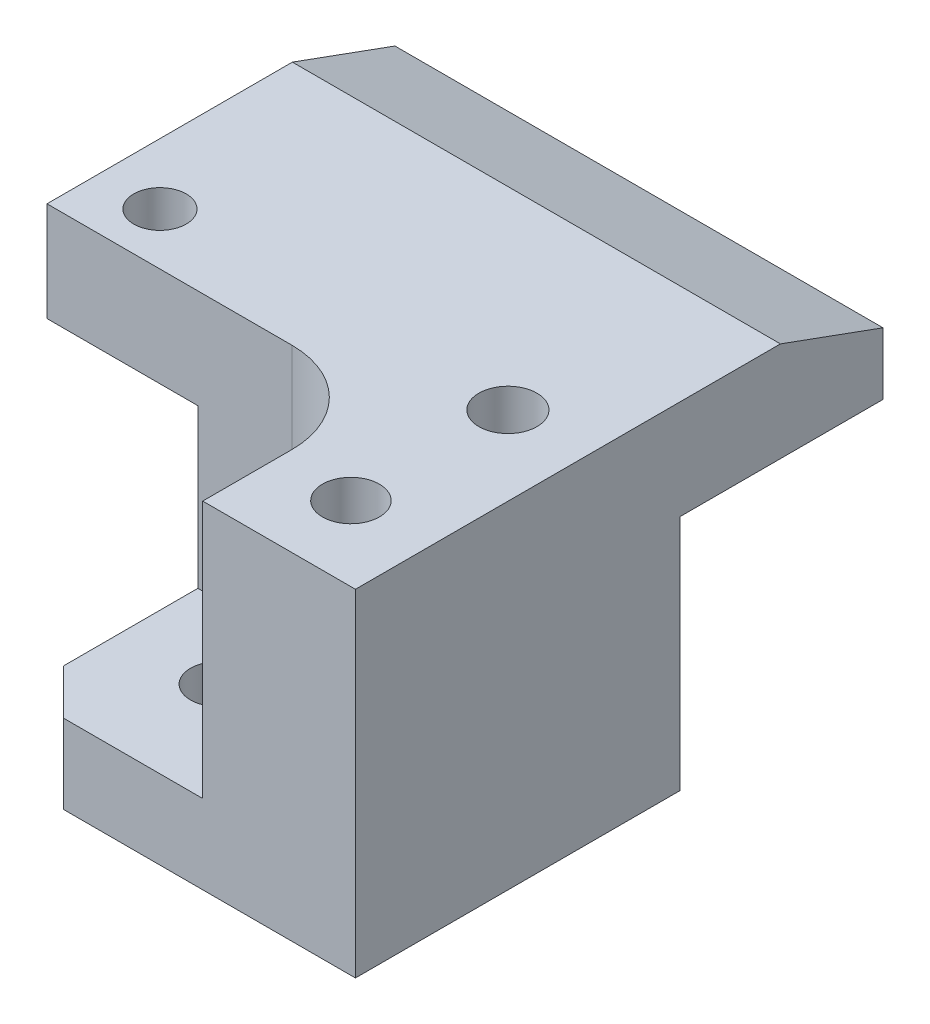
SolidWorks part; units mm, degrees
ref_plane "Front" through (0, 0, 0) normal (0, 0, 1) x (1, 0, 0)
ref_plane "Top" through (0, 0, 0) normal (0, 1, 0) x (1, 0, 0)
ref_plane "CENTER" through (0, 0, 0) normal (1, 0, 0) x (0, 0, -1)
sketch "Sketch1" plane through (0, 0, 0) normal (1, 0, 0) x (0, 0, -1)
  line L0 (-19.558, 0) -> (0, 0)
  line L1 (0, 0) -> (0, 14.478)
  line L2 (0, 14.478) -> (-19.558, 14.478)
  line L3 (-19.558, 14.478) -> (-19.558, 31.3453) construction
  line L7 (-19.558, 14.478) -> (-19.558, 0)
  dimension "D1" = 14.478
extrude "Extrude1" add sketch "Sketch1" along normal blind 13.716 and the other way blind 13.716
sketch "Sketch16" plane through (13.716, 0, 0) normal (1, 0, 0) x (0, 0, -1)
  line L0 (-7.8405, 14.478) -> (-7.8405, 30.48) construction
  line L1 (0, 0) -> (-7.8405, 0)
  line L2 (0, 0) -> (0, 8.89)
  line L3 (0, 8.89) -> (-7.8405, 8.89)
  line L4 (-7.8405, 0) -> (-7.8405, 8.89)
  line L5 (0, 14.478) -> (-19.558, 14.478) construction
  dimension "D1" = 5.588
extrude "Cut-Extrude1" cut sketch "Sketch16" against normal through all
sketch "Sketch15" plane through (0, 0, 0) normal (0, -1, 0) x (1, 0, 0)
  line L1 (5.2356, 7.8405) -> (-5.2356, 7.8405)
  line L2 (5.2356, 7.8405) -> (5.2356, 27.6467)
  line L3 (5.2356, 27.6467) -> (-5.2356, 27.6467)
  line L4 (-5.2356, 7.8405) -> (-5.2356, 27.6467)
  line L5 (-13.716, 7.8405) -> (13.716, 7.8405) construction
  point P6 (0, 7.8405)
extrude "Extrude2" add sketch "Sketch15" along normal blind 4.445
sketch "Sketch19" plane through (0, 0, 19.558) normal (0, 0, 1) x (1, 0, 0)
  line L1 (13.716, 14.478) -> (5.1308, 14.478)
  line L2 (13.716, 14.478) -> (13.716, 8.89)
  line L3 (13.716, 8.89) -> (5.1308, 8.89)
  line L4 (5.1308, 14.478) -> (5.1308, 8.89)
  line L5 (-13.716, 8.89) -> (13.716, 8.89) construction
  line L6 (5.1308, 14.478) -> (5.1308, 31.3453) construction
extrude "Extrude3" add sketch "Sketch19" along normal up to surface (10.095 mm away)
sketch "Sketch20" plane through (0, 8.89, 0) normal (0, -1, 0) x (1, 0, 0)
  line L1 (5.1308, 29.653) -> (13.716, 29.653)
  line L2 (5.1308, 29.653) -> (5.1308, 7.8405)
  line L3 (5.1308, 7.8405) -> (13.716, 7.8405)
  line L4 (13.716, 29.653) -> (13.716, 7.8405)
extrude "Extrude4" add sketch "Sketch20" along normal up to surface (13.335 mm away)
hole_wizard "M3.1 (3.1) Diameter Hole1" positions "Sketch14" profile "Sketch13" hole size "M3.1" standard "Ansi Metric"
sketch "Sketch14" plane through (-3.8106, 0, 4.1629) normal (0, -1, 0) x (1, 0, 0)
  line L0 (2.5164, 19.4901) -> (6.3664, 19.4901) construction
  line L1 (3.8064, 30.291) -> (3.8064, 8.6891) construction
  point P0 (3.8064, 19.4901)
sketch "Sketch13" plane through (-0.0042, 0, 23.653) normal (1, 0, 0) x (0, 0, 1)
  line L0 (0, 0) -> (0, 4.445)
  line L1 (0, 4.445) -> (1.55, 4.445)
  line L2 (1.55, 4.445) -> (1.55, 0)
  line L5 (1.55, 0) -> (0, 0)
  line L11 (0, -6.35) -> (0, 107.95) construction
  dimension "Thru Hole Dia." = 3.1
  dimension "Thru Hole Depth" = 4.445
sketch "Sketch21" plane through (0, 0, 0) normal (0, -1, 0) x (1, 0, 0)
  line L1 (-5.2356, 7.8405) -> (-13.716, 7.8405)
  line L2 (-5.2356, 7.8405) -> (-5.2356, 19.558)
  line L3 (-5.2356, 19.558) -> (-13.716, 19.558)
  line L4 (-13.716, 7.8405) -> (-13.716, 19.558)
extrude "Cut-Extrude2" cut sketch "Sketch21" against normal up to surface (8.89 mm away)
hole_wizard "#32 (0.116) Diameter Hole1" positions "Sketch18" profile "Sketch17" hole size "#32" standard "Ansi Inch"
sketch "Sketch18" plane through (0.0132, 8.89, -8.626) normal (0, -1, 0) x (1, 0, 0)
  line L4 (-13.7292, 8.626) -> (-13.7292, 28.184) construction
  line L5 (-5.2488, 28.184) -> (-13.7292, 28.184) construction
  point P0 (-10.3002, 25.263)
  dimension "D1" = 3.429
  dimension "D2" = 2.921
sketch "Sketch17" plane through (-10.287, 8.89, 16.637) normal (1, 0, 0) x (0, 0, -1)
  line L0 (0, 0) -> (0, 5.588)
  line L1 (0, 5.588) -> (1.4732, 5.588)
  line L2 (1.4732, 5.588) -> (1.4732, 0)
  line L5 (1.4732, 0) -> (0, 0)
  line L11 (0, -6.35) -> (0, 107.95) construction
  dimension "Thru Hole Dia." = 2.9464
  dimension "Thru Hole Depth" = 5.588
sketch "Sketch22" plane through (0, 0, 27.6467) normal (0, 0, 1) x (1, 0, 0)
  line L1 (5.1308, -4.445) -> (-5.2356, -4.445)
  line L2 (5.1308, -4.445) -> (5.1308, 0)
  line L3 (5.1308, 0) -> (-5.2356, 0)
  line L4 (-5.2356, -4.445) -> (-5.2356, 0)
extrude "Extrude5" add sketch "Sketch22" along normal up to surface (2.0063 mm away)
fillet "Fillet1" radius 5.08 1 edges at (5.1308, 7.239, 19.558)
hole_wizard "CBORE for #4 Binding Head Machine Screw1" positions "Sketch26" profile "Sketch25" counterbore size "#4" standard "Ansi Inch"
sketch "Sketch26" plane through (0, -4.445, 0) normal (0, -1, 0) x (1, 0, 0)
  line L0 (-5.2356, 19.558) -> (-13.716, 19.558) construction
  line L1 (13.716, 7.8405) -> (13.716, 29.653) construction
  point P0 (9.271, 16.637)
  dimension "D1" = 2.921
  dimension "D2" = 4.445
sketch "Sketch25" plane through (9.271, -4.445, 16.637) normal (1, 0, 0) x (0, 0, -1)
  line L0 (0, 0) -> (0, 18.923)
  line L1 (0, 18.923) -> (1.6319, 18.923)
  line L3 (1.6319, 18.923) -> (1.6319, 10.16)
  line L4 (1.6319, 10.16) -> (3.3731, 10.16)
  line L5 (3.3731, 10.16) -> (3.3731, 0)
  line L7 (3.3731, 0) -> (0, 0)
  line L11 (0, -6.35) -> (0, 107.95) construction
  dimension "Thru Hole Dia." = 3.2639
  dimension "Thru Hole Depth" = 18.923
  dimension "C'Bore Dia." = 6.7462
  dimension "C'Bore Depth" = 10.16
hole_wizard "1/8 (0.125) Diameter Hole1" positions "Sketch28" profile "Sketch27" hole size "1/8" standard "Ansi Inch"
sketch "Sketch28" plane through (0, 14.478, 0) normal (0, 1, 0) x (-1, 0, 0)
  circle A0 centre (-9.271, 25.462) radius 1.5837 construction
  point P0 (-9.271, 25.462)
sketch "Sketch27" plane through (9.271, 14.478, 25.462) normal (1, 0, 0) x (0, 0, 1)
  line L0 (0, 0) -> (0, 5.08)
  line L1 (0, 5.08) -> (1.6002, 5.08)
  line L2 (1.6002, 5.08) -> (1.6002, 0)
  line L5 (1.6002, 0) -> (0, 0)
  line L10 (0, 5.08) -> (-1.6002, 5.08) construction
  line L11 (0, -6.35) -> (0, 107.95) construction
  dimension "Hole Dia." = 3.2004
  dimension "Hole Depth" = 5.08
  dimension "Drill Angle" = 180
chamfer "Chamfer1" distance 2.54 angle 45 1 edges at (-5.2356, -2.2225, 29.653)
sketch "Sketch24" plane through (0, 0, 7.8405) normal (0, 0, -1) x (-1, 0, 0)
  line L1 (5.2356, -4.445) -> (-13.716, -4.445)
  line L2 (5.2356, -4.445) -> (5.2356, 8.89)
  line L3 (5.2356, 8.89) -> (-13.716, 8.89)
  line L4 (-13.716, -4.445) -> (-13.716, 8.89)
extrude "Cut-Extrude4" cut sketch "Sketch24" against normal blind 3.556
sketch "Sketch23" plane through (0, 0, 0) normal (1, 0, 0) x (0, 0, -1)
  line L0 (0, 14.478) -> (-5.7658, 14.478)
  line L1 (0, 14.478) -> (-29.653, 14.478) construction
  line L2 (-5.7658, 14.478) -> (0, 12.3794)
  line L3 (0, 12.3794) -> (0, 14.478)
  dimension "D1" = 20
  dimension "D2" = 5.7658
extrude "Cut-Extrude3" cut sketch "Sketch23" against normal through all and the other way through all
